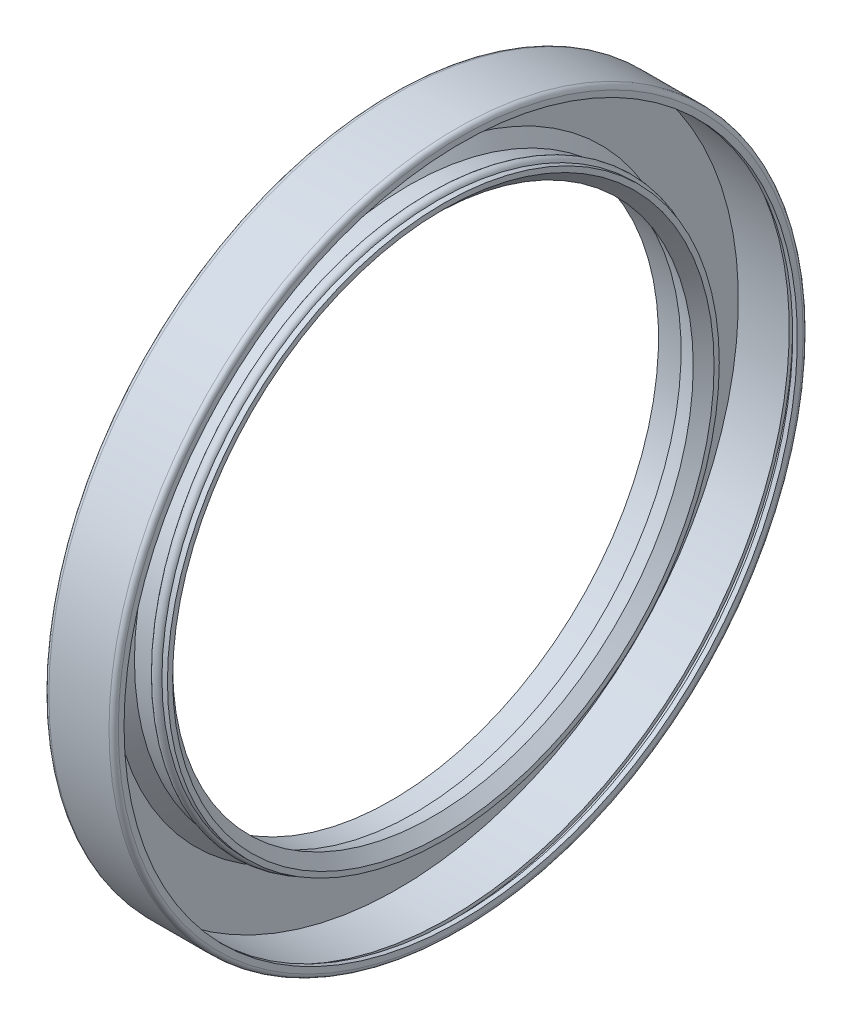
SolidWorks part; units mm, degrees
ref_plane "Plan1" through (0, 0, 0) normal (0, 0, 1) x (1, 0, 0)
ref_plane "Plan2" through (0, 0, 0) normal (0, 1, 0) x (1, 0, 0)
ref_plane "Plan3" through (0, 0, 0) normal (1, 0, 0) x (0, 0, -1)
sketch "Esquisse1" plane through (0, 0, 0) normal (0, 1, 0) x (1, 0, 0)
  line L0 (0, 0) -> (6.6667, 0) construction
  line L1 (0, 30.8) -> (0, 39.4667)
  line L2 (0.5333, 40) -> (7.4667, 40)
  line L3 (6.6667, 39.2) -> (6.6667, 39.6)
  line L4 (6.6667, 39.2) -> (0.8, 39.2)
  line L5 (0.8, 39.2) -> (0.8, 33.0301)
  line L6 (2.602, 30.8) -> (0, 30.8)
  line L9 (6.6667, 39.6) -> (7.4667, 39.6)
  line L11 (7.4667, 39.6) -> (7.4667, 38.8)
  line L12 (8, 38.8) -> (8, 39.4667)
  line L13 (7.4667, 38.8) -> (8, 38.8)
  line L14 (2.602, 30.8) -> (4.8, 30)
  line L15 (4.8, 30) -> (6, 31.2)
  line L16 (6, 31.2) -> (6, 31.8)
  line L17 (6, 31.8) -> (5.3657, 31.8)
  line L18 (0.8, 33.0301) -> (2, 31.6)
  line L22 (2, 31.6) -> (4.2, 31.6)
  arc A0 (0, 39.4667) -> (0.5333, 40) centre (0.5333, 39.4667) cw
  arc A1 (5.3657, 31.8) -> (4.2, 31.6) centre (4.8, 31.6) ccw
  arc A2 (7.4667, 40) -> (8, 39.4667) centre (7.4667, 39.4667) cw
  point P13 (0, 40)
  point P22 (8, 40)
  dimension "r" = 0.5333
  dimension "l" = 1.2
  dimension "D1" = 130
  dimension "De" = 40
  dimension "b" = 8
  dimension "e" = 0.8
  dimension "D7" = 45
  dimension "D6" = 20
  dimension "Di" = 30
  dimension "pl" = 6
  dimension "h" = 0.2
revolve "Base-Révolution" add sketch "Esquisse1" angle 360 about L0
sketch "Esquisse2" plane through (0, 0, 0) normal (-1, 0, 0) x (0, 0, 1)
  line L0 (0, 0) -> (30.8, 0) construction
  line L1 (30.8, 0) -> (31.2, 0) construction
  circle A0 centre (0, 0) radius 30.8 construction
  circle A2 centre (0, 0) radius 30.8 construction
  circle A3 centre (0, 0) radius 31.2
equation "\"e@Esquisse1\" = \"b@Esquisse1\"/10"
equation "\"i@Esquisse1\"=\"e@Esquisse1\"/2"
equation "\"r@Esquisse1\"=\"e@Esquisse1\"*2/3"
equation "\"l@Esquisse1\"=\"i@Esquisse1\"*3"
equation "\"pl@Esquisse1\"=\"b@Esquisse1\"*3/4"
equation "\"h@Esquisse1\"=\"i@Esquisse1\"/2"
